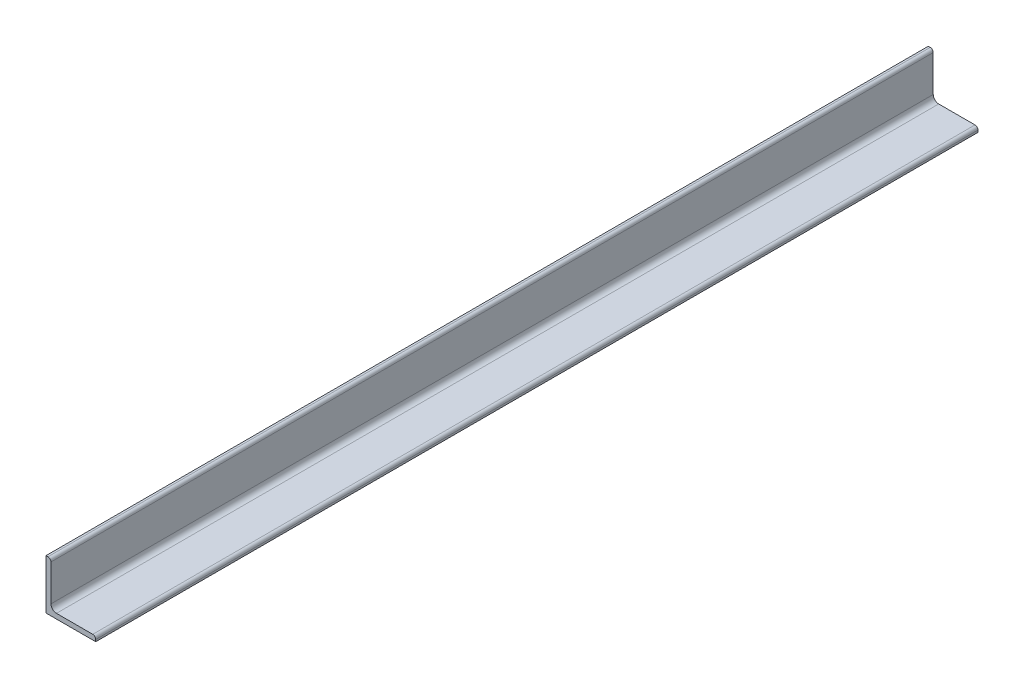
SolidWorks part; units mm, degrees
ref_plane "前视基准面" through (0, 0, 0) normal (0, 0, 1) x (1, 0, 0)
ref_plane "上视基准面" through (0, 0, 0) normal (0, 1, 0) x (1, 0, 0)
ref_plane "右视基准面" through (0, 0, 0) normal (1, 0, 0) x (0, 0, -1)
sketch "草图1" plane through (0, 0, 0) normal (0, 0, 1) x (1, 0, 0)
  line L0 (0, 50) -> (0, 0)
  line L1 (0, 0) -> (50, 0)
  line L2 (50, 0) -> (50, 2)
  line L3 (47, 5) -> (10.5, 5)
  line L4 (5, 10.5) -> (5, 47)
  line L5 (2, 50) -> (0, 50)
  arc A0 (10.5, 5) -> (5, 10.5) centre (10.5, 10.5) cw
  arc A1 (5, 47) -> (2, 50) centre (2, 47) ccw
  arc A2 (50, 2) -> (47, 5) centre (47, 2) ccw
  dimension "D5" = 5.5
  dimension "D6" = 3
  dimension "D1" = 5
  dimension "D2" = 5
  dimension "D3" = 50
  dimension "D4" = 50
extrude "拉伸1" add sketch "草图1" along normal blind 887
